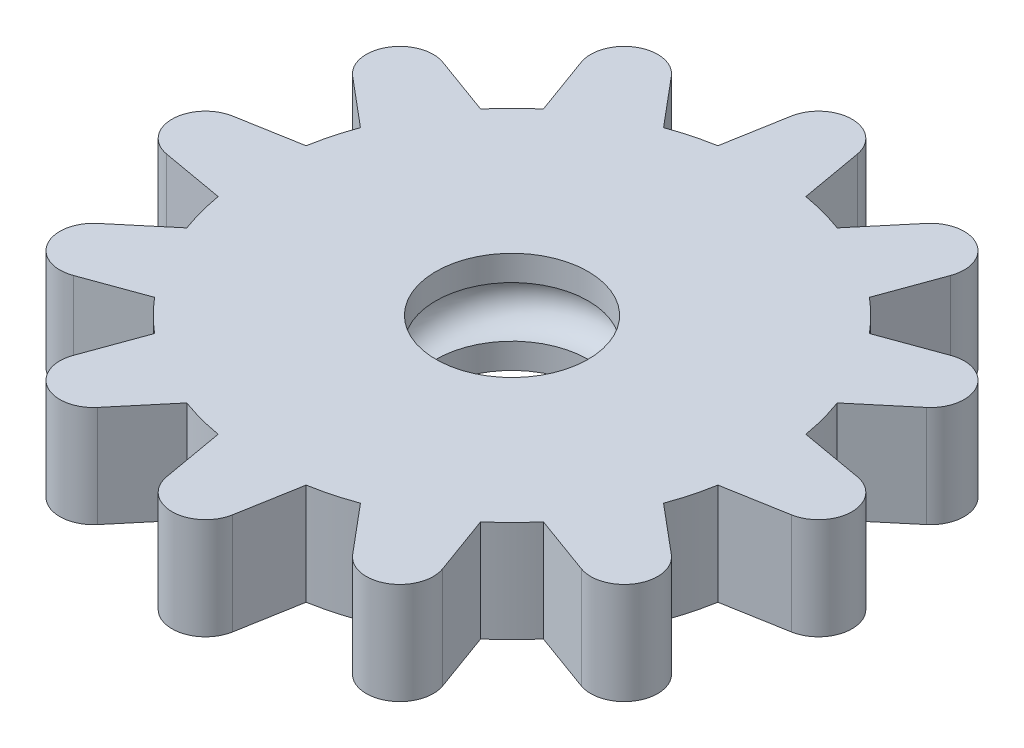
SolidWorks part; units mm, degrees
ref_plane "Front Plane" through (0, 0, 0) normal (0, 0, 1) x (1, 0, 0)
ref_plane "Top Plane" through (0, 0, 0) normal (0, 1, 0) x (1, 0, 0)
ref_plane "Right Plane" through (0, 0, 0) normal (1, 0, 0) x (0, 0, -1)
sketch "Sketch1" plane through (0, 0, 0) normal (0, 1, 0) x (1, 0, 0)
  circle A0 centre (0, 0) radius 5
  dimension "D1" = 10
extrude "Boss-Extrude1" add sketch "Sketch1" along normal blind 2
sketch "Sketch2" plane through (0, 2, 0) normal (0, 1, 0) x (1, 0, 0)
  line L0 (0, 0) -> (0, 5.2684) construction
  line L1 (0, 5) -> (5.6498, 5) construction
  line L2 (0.8669, 4.9243) -> (-0.8669, 4.9243)
  line L3 (0.8669, 4.9243) -> (0.65, 6.1546)
  line L4 (-0.8669, 4.9243) -> (-0.65, 6.1546)
  line L5 (0, 6.7) -> (1.7382, 6.7) construction
  arc A0 (0.65, 6.1546) -> (-0.65, 6.1546) centre (0, 6.04) ccw
  circle A1 centre (0, 0) radius 5 construction
  point P11 (0, 4.9243)
  dimension "D1" = 80
  dimension "D2" = 0.65
  dimension "D3" = 1.7
extrude "Boss-Extrude4" add sketch "Sketch2" against normal blind 2
sketch "Sketch3" plane through (0, 0, 0) normal (1, 0, 0) x (0, 0, -1)
  line L0 (0, 0) -> (0, 4.2221) construction
pattern_circular "CirPattern1" count 12 over 360 about axis through (0, 0, 0) along (0, 1, 0) of "Boss-Extrude4"
ref_point "Point1"
ref_point "Point2"
ref_axis "Axis1" through (0, -2.0573, 0) along (0, 1, 0)
sketch "Sketch4" plane through (0, 0, 0) normal (1, 0, 0) x (0, 0, -1)
  line L2 (0, -2.0573) -> (0, 4.4685) construction
  line L4 (0, 2) -> (1.5, 2)
  line L5 (0, 2) -> (0, 0)
  line L6 (0, 0) -> (1.5, 0)
  line L7 (1.5, 2) -> (1.5, 1.5)
  line L8 (1.7113, 0) -> (2.5144, 0) construction
  line L9 (1.5, 0.5) -> (1.5, 0)
  arc A0 (1.5, 0.5) -> (1.5, 1.5) centre (1.5, 1) ccw
  dimension "D2" = 1
  dimension "D1" = 1.5
  dimension "D3" = 0.5
  dimension "D4" = 0.5
  dimension "D5" = 0
revolve "Cut-Revolve2" cut sketch "Sketch4" angle 360 about axis through (0, -2.0573, 0) along (0, 1, 0)
